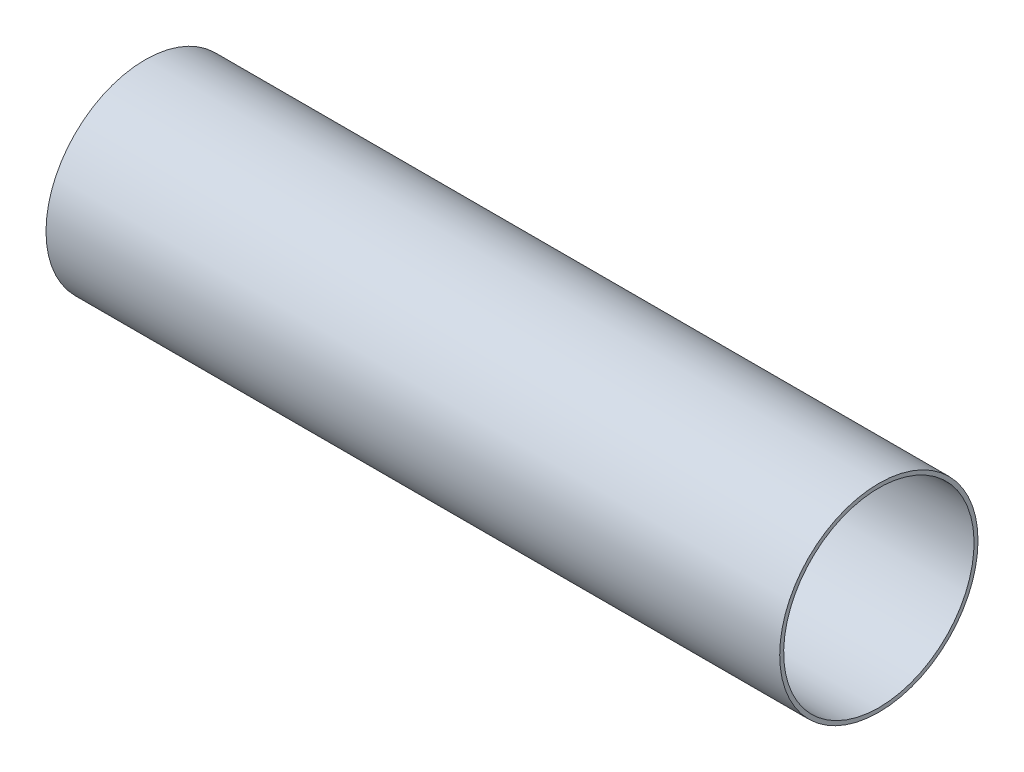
SolidWorks part; units mm, degrees
ref_plane "Plan1" through (0, 0, 0) normal (0, 0, 1) x (1, 0, 0)
ref_plane "Plan2" through (0, 0, 0) normal (0, 1, 0) x (1, 0, 0)
ref_plane "Plan3" through (0, 0, 0) normal (1, 0, 0) x (0, 0, -1)
sketch "Esquisse1" plane through (0, 0, 0) normal (0, 0, 1) x (1, 0, 0)
  line L0 (-141.928, 0) -> (141.928, 0) construction
  line L2 (-92.5, 25) -> (92.5, 25)
  line L3 (-92.5, 25) -> (-92.5, 24)
  line L4 (-92.5, 24) -> (92.5, 24)
  line L5 (92.5, 25) -> (92.5, 24)
  dimension "D1" = 185
  dimension "D2" = 48
  dimension "D3" = 50
  dimension "D4" = 92.5
revolve "Base-Révolution" add sketch "Esquisse1" angle 360 about L0
